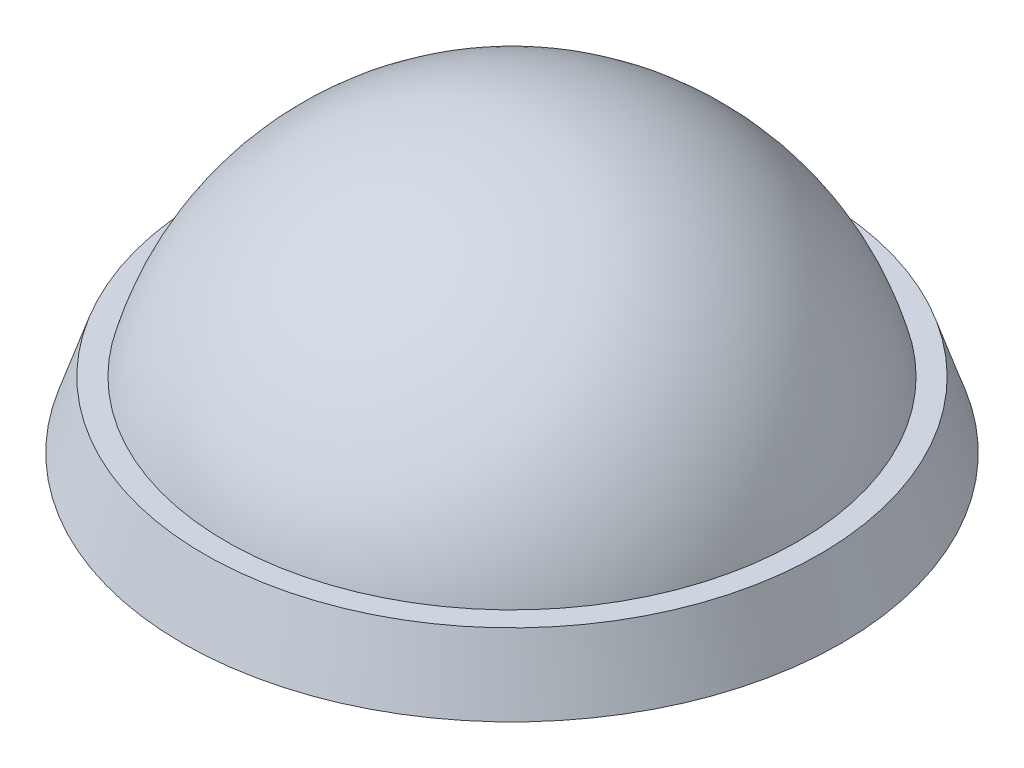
SolidWorks part; units mm, degrees
ref_plane "Front Plane" through (0, 0, 0) normal (0, 0, 1) x (1, 0, 0)
ref_plane "Top Plane" through (0, 0, 0) normal (0, 1, 0) x (1, 0, 0)
ref_plane "Right Plane" through (0, 0, 0) normal (1, 0, 0) x (0, 0, -1)
sketch "Sketch1" plane through (0, 0, 0) normal (0, 0, 1) x (1, 0, 0)
  line L0 (14.8295, 3) -> (14.8278, 0)
  line L1 (14.8278, 0) -> (19.8278, 0)
  line L2 (4.8278, 0) -> (4.8278, 13) construction
  line L4 (18.8278, 3) -> (17.8278, 3)
  line L6 (4.8278, 10.13) -> (4.8278, 13)
  line L8 (18.8278, 3) -> (19.8278, 0)
  line L12 (7.6978, 2.87) -> (14.8278, 2.87) construction
  line L13 (14.8278, 2.87) -> (14.8734, 2.87) construction
  line L14 (14.8734, 2.87) -> (14.8734, 2.87) construction
  line L15 (14.8734, 2.87) -> (14.8734, 2.87) construction
  line L16 (7.6978, 2.87) -> (7.6978, 9.7333) construction
  line L17 (4.8278, 0) -> (14.8278, 0) construction
  arc A0 (4.8278, 13) -> (17.8278, 3) centre (4.8278, -0.45) cw
  arc A1 (4.8278, 10.13) -> (14.8295, 3) centre (4.8278, -0.45) cw
  arc A2 (7.6978, 9.7333) -> (14.8734, 2.87) centre (4.8278, -0.45) cw construction
  point P18 (0, 0)
revolve "Revolve1" add sketch "Sketch1" angle 360 about L6
